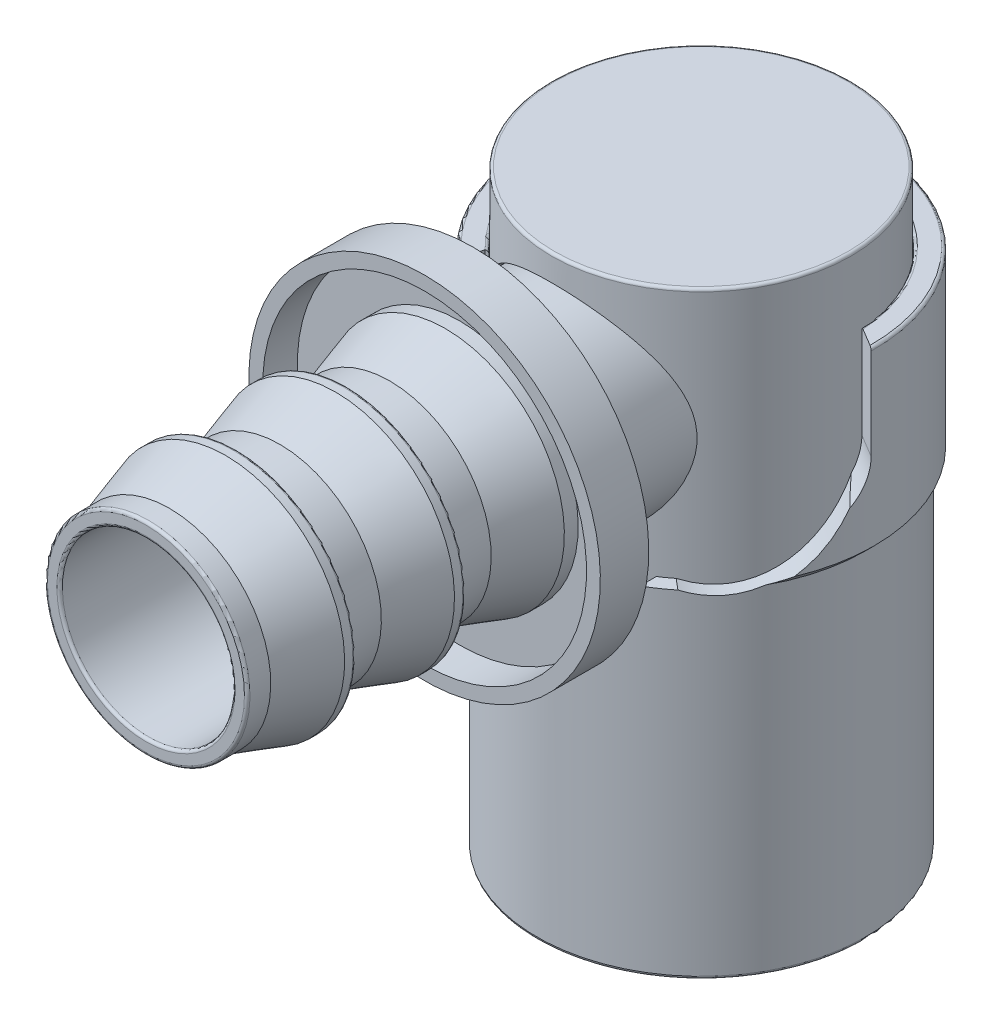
SolidWorks part; units mm, degrees
ref_plane "Front Plane" through (0, 0, 0) normal (0, 0, 1) x (1, 0, 0)
ref_plane "Top Plane" through (0, 0, 0) normal (0, 1, 0) x (1, 0, 0)
ref_plane "Right Plane" through (0, 0, 0) normal (1, 0, 0) x (0, 0, -1)
imported_body "BODY"
imported_body "SLEEVE"
imported_body "BARB"
imported_body "HOSE STOP"
sketch "Sketch1" plane through (0, 0, 0) normal (1, 0, 0) x (0, 0, -1)
  line L0 (-7.9248, 33.001) -> (-7.9248, 23.9776) construction
  line L1 (-10.668, 23.9776) -> (-7.9248, 23.9776)
  line L2 (-10.668, 23.9776) -> (-10.668, 17.8816)
  line L3 (-10.668, 17.8816) -> (-7.9248, 17.8816)
  line L4 (-7.9248, 23.9776) -> (-7.9248, 17.8816)
  line L5 (-10.668, 23.9776) -> (10.668, 23.9776) construction
  line L6 (0, 25.3574) -> (0, 18.5471) construction
  dimension "D1" = 6.096
revolve "SC500S-V" add sketch "Sketch1" angle 360 about L6
